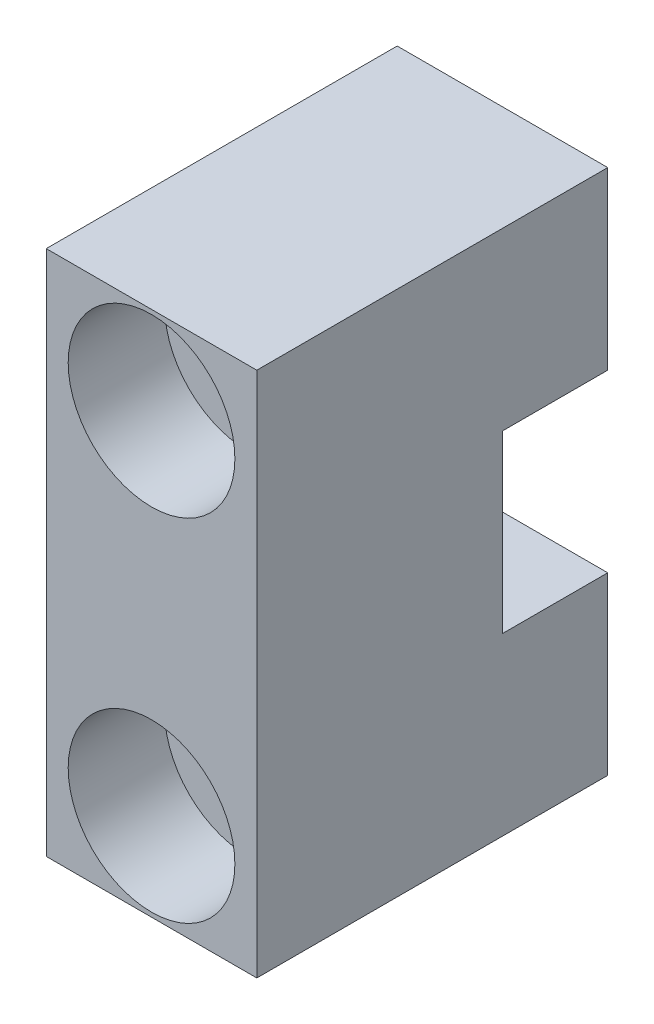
SolidWorks part; units mm, degrees
ref_plane "前视基准面" through (0, 0, 0) normal (0, 0, 1) x (1, 0, 0)
ref_plane "上视基准面" through (0, 0, 0) normal (0, 1, 0) x (1, 0, 0)
ref_plane "右视基准面" through (0, 0, 0) normal (1, 0, 0) x (0, 0, -1)
sketch "草图1" plane through (0, 0, 0) normal (0, 0, 1) x (1, 0, 0)
  line L0 (0, -30) -> (0, 0)
  line L1 (12, -30) -> (12, 0)
  line L2 (0, 0) -> (12, 0)
  line L3 (0, -30) -> (12, -30)
  circle A0 centre (6, -25) radius 2.75
  circle A1 centre (6, -5) radius 2.75
extrude "凸台-拉伸1" add sketch "草图1" along normal blind 20
sketch "草图2" plane through (12, 0, 0) normal (1, 0, 0) x (0, 0, -1)
  line L0 (0, -30) -> (0, 0) construction
  line L1 (4.6822, -10) -> (-6, -10)
  line L2 (4.6822, -10) -> (4.6822, -20)
  line L3 (4.6822, -20) -> (-6, -20)
  line L4 (-6, -10) -> (-6, -20)
  line L5 (-20, -15) -> (2.4434, -15) construction
  line L6 (-20, -30) -> (-20, 0) construction
  dimension "D1" = 10
  dimension "D2" = 6
extrude "切除-拉伸1" cut sketch "草图2" against normal blind 20
sketch "草图3" plane through (0, 0, 20) normal (0, 0, 1) x (1, 0, 0)
  circle A0 centre (6, -25) radius 4.75
  circle A1 centre (6, -5) radius 4.75
extrude "切除-拉伸2" cut sketch "草图3" against normal blind 5.5
